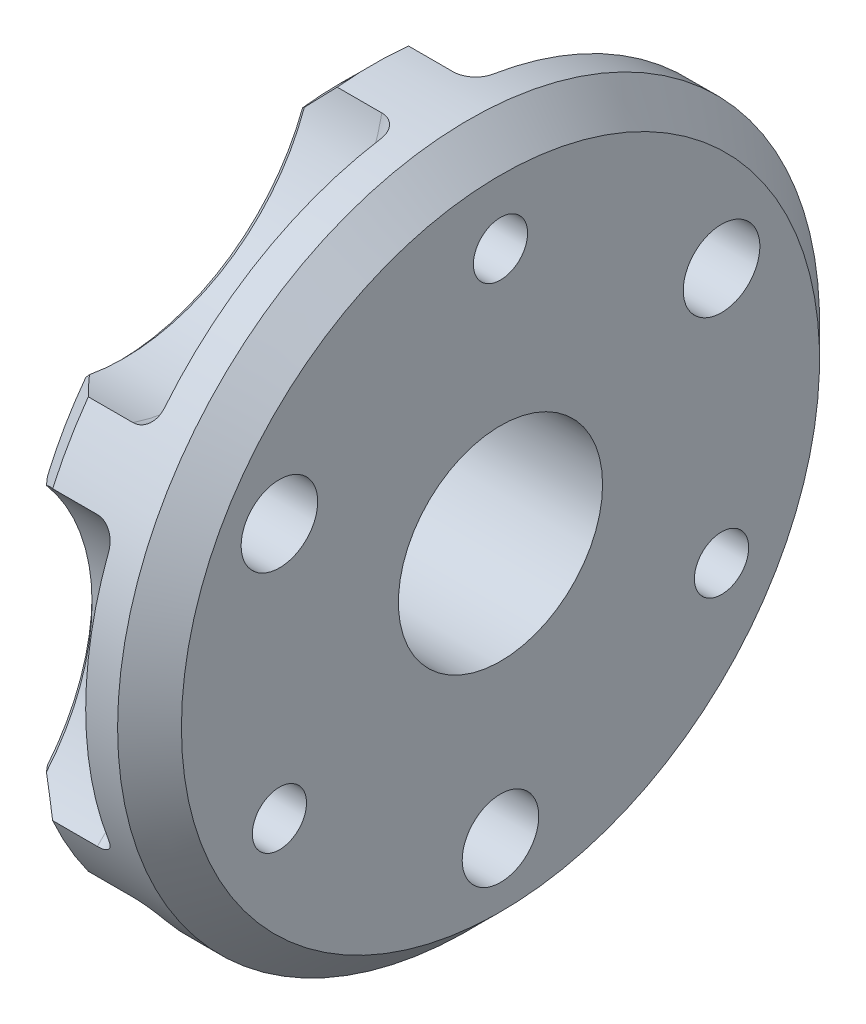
SolidWorks part; units mm, degrees
ref_plane "Plan de face" through (0, 0, 0) normal (0, 0, 1) x (1, 0, 0)
ref_plane "Plan de dessus" through (0, 0, 0) normal (0, 1, 0) x (1, 0, 0)
ref_plane "Plan de droite" through (0, 0, 0) normal (1, 0, 0) x (0, 0, -1)
sketch "Esquisse1" plane through (0, 0, 0) normal (0, 0, 1) x (1, 0, 0)
  line L0 (0, 0) -> (159.7018, 0) construction
  line L1 (0, 11) -> (0, 29)
  line L2 (0, 29) -> (4, 29)
  line L3 (4, 29) -> (4, 50)
  line L4 (9, 55) -> (29, 55)
  line L5 (36, 48) -> (36, 37)
  line L6 (36, 37) -> (23, 30)
  line L7 (23, 30) -> (23, 20.1)
  line L8 (23, 20.1) -> (11, 20.1)
  line L9 (11, 20.1) -> (11, 11)
  line L10 (11, 11) -> (0, 11)
  line L11 (4, 50) -> (9, 55)
  line L12 (29, 55) -> (36, 48)
  point P6 (4, 55)
  point P7 (36, 55)
  dimension "D1" = 11
  dimension "D2" = 36
  dimension "D3" = 36
  dimension "D4" = 29
  dimension "D5" = 4
  dimension "D6" = 13
  dimension "D7" = 37
  dimension "D8" = 30
  dimension "D9" = 55
  dimension "D10" = 20.1
  dimension "D11" = 25
revolve "Révolution1" add sketch "Esquisse1" angle 360 about L0
hole_wizard "Trou taraudé M101" positions "Esquisse3D1" profile "Esquisse3" tap size "M10" standard "ISO"
sketch3d "Esquisse3D1"
  line L4 (4, 0, 0) -> (4, 40, 0) construction
  line L5 (9, 0, 0) -> (4, 0, 0) construction
  line L7 (4, -20, -34.641) -> (4, 0, 0) construction
  line L8 (4, -20, 34.641) -> (4, 0, 0) construction
  point P0 (4, 40, 0)
  point P4 (4, -20, 34.641)
  point P8 (4, -20, -34.641)
  dimension "D1" = 40
  dimension "D2" = 120
  dimension "D3" = 120
sketch "Esquisse3" plane through (4, 40, 0) normal (0, 1, 0) x (0, 0, 1)
  line L0 (0, 0) -> (0, 32)
  line L1 (0, 32) -> (4.25, 32)
  line L2 (4.25, 32) -> (4.25, 0)
  line L5 (4.25, 0) -> (0, 0)
  line L11 (0, -6.35) -> (0, 107.95) construction
  dimension "Diamètre du trou pour taraudage jusqu'au prochain" = 8.5
  dimension "Profondeur du trou pour taraudage jusqu'au prochain" = 32
sketch "Esquisse4" plane through (4, 0, 0) normal (-1, 0, 0) x (0, 0, 1)
  line L0 (0, 0) -> (0, 40) construction
  line L1 (0, 0) -> (34.641, -20) construction
  line L2 (0, 0) -> (66.1937, 38.217) construction
  circle A0 centre (34.641, 20) radius 9.05
  circle A1 centre (0, -40) radius 9.05
  circle A2 centre (-34.641, 20) radius 9.05
  dimension "D4" = 18.1
  dimension "D5" = 69.282
  dimension "D1" = 120
  dimension "D2" = 60
  dimension "D3" = 40
  dimension "D6" = 20
extrude "Extrusion2" cut sketch "Esquisse4" against normal blind 10.6
sketch "Esquisse5" plane through (14.6, 0, 0) normal (-1, 0, 0) x (0, 0, 1)
  circle A0 centre (34.641, 20) radius 6
  circle A1 centre (-34.641, 20) radius 6
  circle A2 centre (0, -40) radius 6
  dimension "D1" = 12
extrude "Extrusion3" cut sketch "Esquisse5" against normal blind 30.6
sketch "Esquisse6" plane through (4, 0, 0) normal (-1, 0, 0) x (0, 0, 1)
  line L0 (0, 0) -> (0, 40) construction
  line L1 (0, 0) -> (34.641, 20) construction
  line L2 (0, 0) -> (35, 60.6218) construction
  circle A0 centre (35, 60.6218) radius 30
  circle A1 centre (70, 0) radius 30
  circle A2 centre (35, -60.6218) radius 30
  circle A3 centre (-35, -60.6218) radius 30
  circle A4 centre (-70, 0) radius 30
  circle A5 centre (-35, 60.6218) radius 30
  dimension "D4" = 60
  dimension "D1" = 60
  dimension "D2" = 30
  dimension "D3" = 70
extrude "Extrusion4" cut sketch "Esquisse6" against normal blind 15
chamfer "Chanfrein1" distance 1 angle 45 6 edges at (4, 34.641, -20) (4, 0, -40) (4, -34.641, -20) (4, -34.641, 20) (4, 0, 40) (4, 34.641, 20)
fillet "Congé1" radius 3 6 edges at (19, -34.641, 20) (19, -34.641, -20) (19, 0, -40) (19, 34.641, -20) (19, 34.641, 20) (19, 0, 40)
sketch "Esquisse7" plane through (29, 0, 0) normal (-1, 0, 0) x (0, 0, 1)
  circle A0 centre (0, 0) radius 55 construction
  circle A1 centre (0, 0) radius 55
extrude "Enlèv. mat.-Extru.1" cut sketch "Esquisse7" against normal through all
chamfer "Chanfrein2" distance 5 angle 45 1 edges at (29, 0, 55)
sketch "Esquisse8" plane through (29, 0, 0) normal (1, 0, 0) x (0, 0, -1)
  circle A0 centre (0, 0) radius 33.2308 construction
  circle A1 centre (0, 0) radius 11 construction
  circle A2 centre (0, 0) radius 33.2308
  circle A3 centre (0, 0) radius 11
extrude "Boss.-Extru.1" add sketch "Esquisse8" against normal up to surface (14.4 mm away)
sketch "Esquisse9" plane through (14.6, 0, 0) normal (-1, 0, 0) x (0, 0, 1)
  circle A0 centre (0, 0) radius 11 construction
  circle A1 centre (0, 0) radius 20.1
  circle A2 centre (0, 0) radius 20.1
  circle A3 centre (0, 0) radius 11
  dimension "D1" = 0
extrude "Boss.-Extru.2" add sketch "Esquisse9" along normal up to surface (3.6 mm away)
sketch "Esquisse11" plane through (29, 0, 0) normal (1, 0, 0) x (0, 0, -1)
  circle A0 centre (0, 0) radius 11 construction
  circle A2 centre (0, 0) radius 16
  dimension "D1" = 32
extrude "Enlèv. mat.-Extru.2" cut sketch "Esquisse11" against normal through all
sketch "Esquisse12" plane through (0, 0, 0) normal (-1, 0, 0) x (0, 0, 1)
  circle A1 centre (0, 0) radius 29
  circle A2 centre (0, 0) radius 29
  dimension "D1" = 0
extrude "Enlèv. mat.-Extru.3" cut sketch "Esquisse12" against normal blind 1
